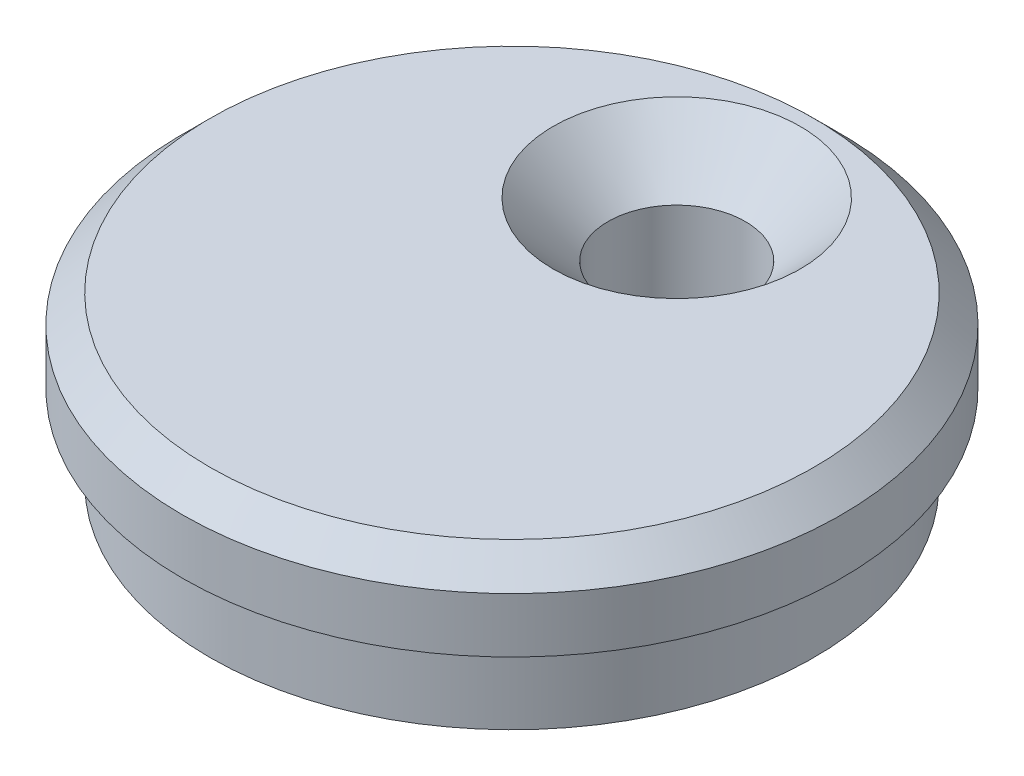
SolidWorks part; units mm, degrees
ref_plane "Front Plane" through (0, 0, 0) normal (0, 0, 1) x (1, 0, 0)
ref_plane "Top Plane" through (0, 0, 0) normal (0, 1, 0) x (1, 0, 0)
ref_plane "Right Plane" through (0, 0, 0) normal (1, 0, 0) x (0, 0, -1)
sketch "Sketch1" plane through (0, 0, 0) normal (0, 1, 0) x (1, 0, 0)
  circle A0 centre (0, 0) radius 11
  dimension "D1" = 22
extrude "Extrude1" add sketch "Sketch1" along normal blind 3
sketch "Sketch2" plane through (0, 3, 0) normal (0, 1, 0) x (1, 0, 0)
  circle A0 centre (0, 0) radius 12
  dimension "D1" = 24
extrude "Extrude2" add sketch "Sketch2" along normal blind 3
chamfer "Chamfer1" distance 1 angle 45 1 edges at (0, 6, 12)
sketch "Sketch3" plane through (0, 6, 0) normal (0, 1, 0) x (1, 0, 0)
  line L0 (0, 0) -> (0, 12) construction
  circle A0 centre (0, 0) radius 12 construction
  point P6 (0, 6)
  dimension "D1" = 6
hole_wizard "CSK for M5 Countersunk Flat Head Screw1" positions "3DSketch1" profile "Sketch4" countersink size "M5" standard "ISO"
sketch3d "3DSketch1"
  point P0 (0, 6, -6)
sketch "Sketch4" plane through (0, 6, -6) normal (1, 0, 0) x (0, 0, 1)
  line L0 (0, 0) -> (0, 6)
  line L1 (0, 6) -> (2.5, 6)
  line L2 (2.5, 6) -> (2.5, 2)
  line L3 (2.5, 2) -> (4.5, 0)
  line L5 (4.5, 0) -> (0, 0)
  line L6 (-2.5, 2) -> (-4.5, 0) construction
  line L11 (0, -6.35) -> (0, 107.95) construction
  dimension "Thru Hole Dia." = 5
  dimension "Thru Hole Depth" = 6
  dimension "Near C'Sink Dia." = 9
  dimension "Near C'Sink Angle" = 90
